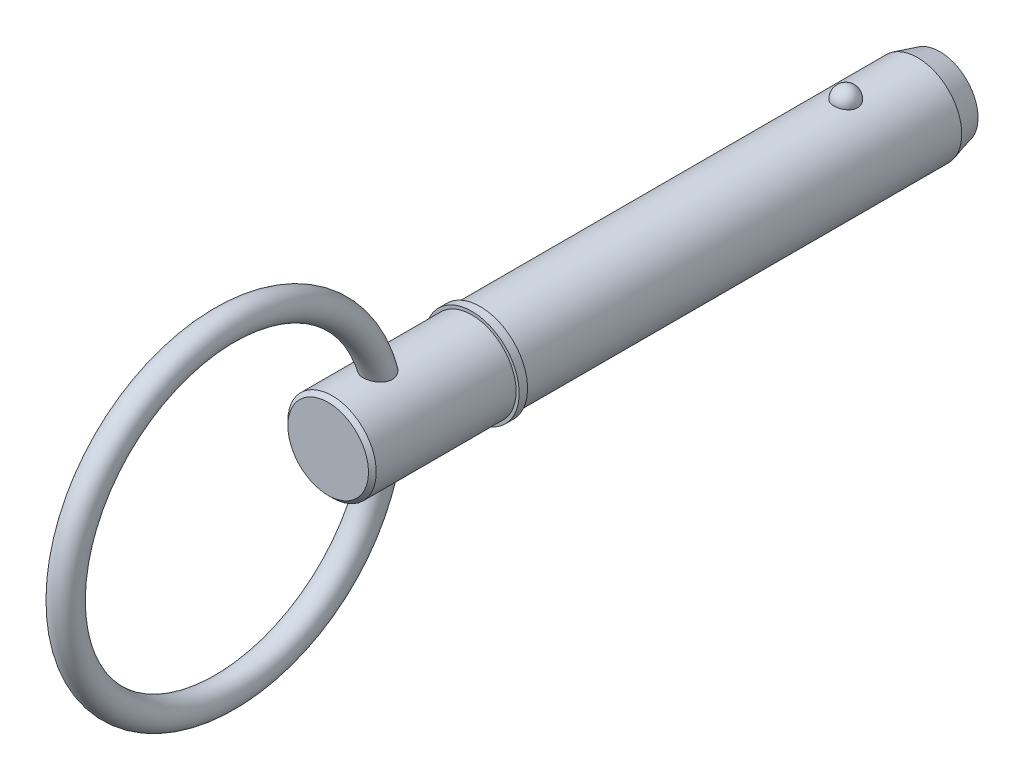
SolidWorks part; units mm, degrees
ref_plane "Front Plane" through (0, 0, 0) normal (0, 0, 1) x (1, 0, 0)
ref_plane "Top Plane" through (0, 0, 0) normal (0, 1, 0) x (1, 0, 0)
ref_plane "Right Plane" through (0, 0, 0) normal (1, 0, 0) x (0, 0, -1)
sketch "Sketch2" plane through (0, 0, 0) normal (0, 0, 1) x (1, 0, 0)
  circle A0 centre (0, 0) radius 7.94
  point P3 (0, 7.94)
  dimension "D1" = 15.88
extrude "Boss-Extrude1" add sketch "Sketch2" along normal blind 63.5
sketch "Sketch3" plane through (0, 0, 0) normal (0, 0, -1) x (-1, 0, 0)
  circle A0 centre (0, 0) radius 7.94
  dimension "D1" = 15.88
extrude "Boss-Extrude2" add sketch "Sketch3" along normal blind 19.05
chamfer "Chamfer1" distance 4 angle 15 1 edges at (-7.94, 0, -19.05)
sketch "Sketch18" plane through (0, 0, 0) normal (1, 0, 0) x (0, 0, -1)
  line L0 (15.05, 7.94) -> (-63.5, 7.94) construction
  line L1 (2.15, 10.09) -> (2.15, 5.79)
  line L2 (-63.5, -7.94) -> (15.05, -7.94) construction
  arc A0 (2.15, 10.09) -> (2.15, 5.79) centre (2.15, 7.94) ccw
  point P4 (0, 7.94)
  dimension "D1" = 18.03
revolve "Revolve1" add sketch "Sketch18" angle 360 about L1
sketch "Sketch19" plane through (0, 0, 0) normal (1, 0, 0) x (0, 0, -1)
  line L0 (-33.7288, 0) -> (-46.4542, 0) construction
sketch "Sketch20" plane through (0, 0, 0) normal (1, 0, 0) x (0, 0, -1)
  line L0 (-63.5, 0) -> (-63.5, 8.5)
  line L1 (-63.5, 7.94) -> (-63.5, -7.94) construction
  line L2 (-63.5, 8.5) -> (-65, 8.5)
  line L3 (-65, 8.5) -> (-65, 0)
  line L4 (-33.7288, 0) -> (-46.4542, 0) construction
  line L5 (-65, 0) -> (-63.5, 0)
  dimension "D1" = 8.5
  dimension "D2" = 1.5
revolve "Revolve2" add sketch "Sketch20" angle 360 about L0
sketch "Sketch21" plane through (0, 0, 63.5) normal (0, 0, -1) x (-1, 0, 0)
  circle A0 centre (0, 0) radius 7.94
  dimension "D1" = 15.88
extrude "Boss-Extrude3" add sketch "Sketch21" against normal blind 27.31
chamfer "Chamfer2" distance 0.7 angle 45 1 edges at (-7.94, 0, 90.81)
sketch "Sketch23" plane through (0, 0, 0) normal (1, 0, 0) x (0, 0, -1)
  line L0 (-90.81, 7.24) -> (-90.81, -7.24) construction
  circle A0 centre (-109.385, 0) radius 28.575
  point P2 (-80.81, 0)
  dimension "D1" = 57.15
  dimension "D2" = 10
sketch "Sketch24" plane through (0, 0, 0) normal (0, 1, 0) x (1, 0, 0)
  circle A0 centre (0, -80.81) radius 2.5
  dimension "D1" = 5
sweep "Sweep1" add profiles "Sketch24" path "Sketch23"
